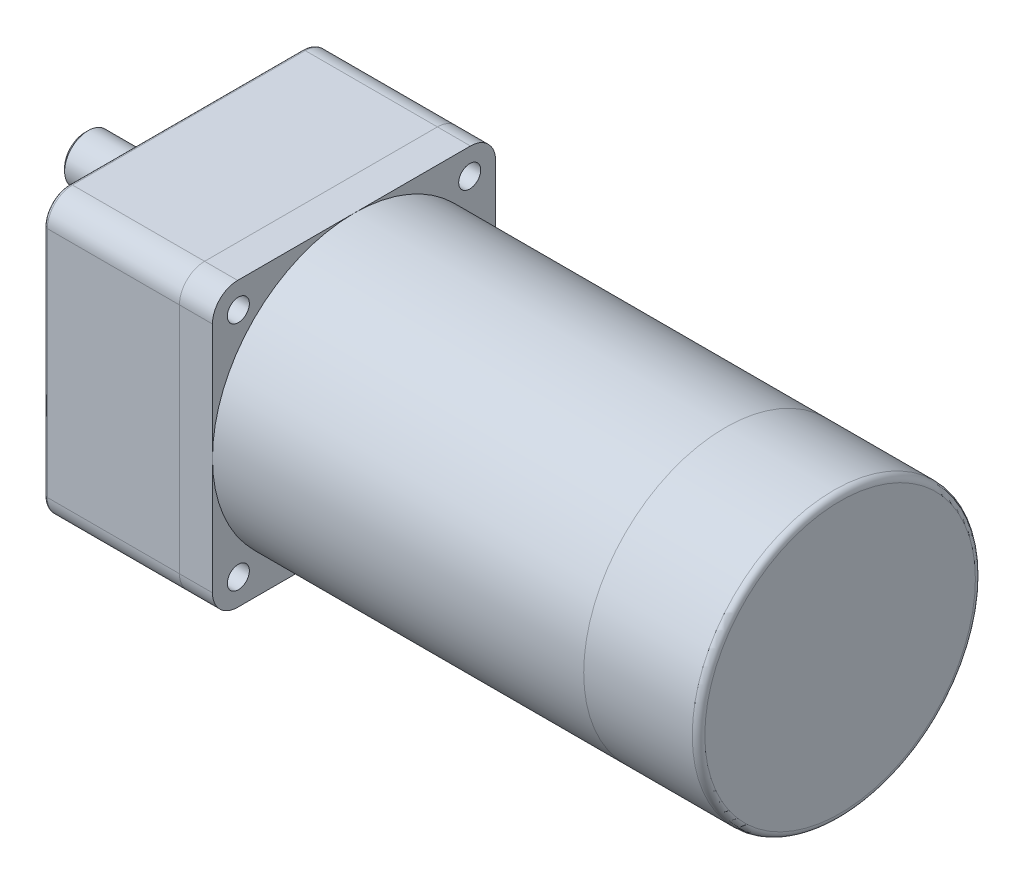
SolidWorks part; units mm, degrees
ref_plane "前视基准面" through (0, 0, 0) normal (0, 0, 1) x (1, 0, 0)
ref_plane "上视基准面" through (0, 0, 0) normal (0, 1, 0) x (1, 0, 0)
ref_plane "右视基准面" through (0, 0, 0) normal (1, 0, 0) x (0, 0, -1)
sketch "草图1" plane through (0, 0, 0) normal (1, 0, 0) x (0, 0, -1)
  line L1 (-37, -45) -> (37, -45)
  line L2 (-45, -37) -> (-45, 37)
  line L3 (-37, 45) -> (37, 45)
  line L4 (45, -37) -> (45, 37)
  line L5 (-45, -45) -> (45, 45) construction
  line L6 (-45, 45) -> (45, -45) construction
  arc A0 (-37, -45) -> (-45, -37) centre (-37, -37) cw
  arc A1 (37, -45) -> (45, -37) centre (37, -37) ccw
  arc A2 (37, 45) -> (45, 37) centre (37, 37) cw
  arc A3 (-45, 37) -> (-37, 45) centre (-37, 37) cw
  point P0 (0, 0)
  dimension "D1" = 8
extrude "凸台-拉伸1" add sketch "草图1" along normal blind 43
sketch "草图2" plane through (43, 0, 0) normal (1, 0, 0) x (0, 0, -1)
  line L0 (37, 45) -> (-37, 45) construction
  line L1 (-37, -45) -> (37, -45)
  line L2 (-45, -37) -> (-45, 37)
  line L3 (-37, 45) -> (37, 45)
  line L4 (45, -37) -> (45, 37)
  line L5 (-45, -45) -> (45, 45) construction
  line L6 (-45, 45) -> (45, -45) construction
  arc A0 (37, 45) -> (45, 37) centre (37, 37) cw
  arc A1 (37, -45) -> (45, -37) centre (37, -37) ccw
  arc A2 (-37, -45) -> (-45, -37) centre (-37, -37) cw
  arc A3 (-45, 37) -> (-37, 45) centre (-37, 37) cw
  point P0 (0, 0)
  dimension "D1" = 8
extrude "凸台-拉伸2" add sketch "草图2" along normal blind 10.5 separate body
fillet "圆角1" radius 1 8 edges at (0, -45, 0) (0, -42.6569, -42.6569) (0, 0, -45) (0, 42.6569, -42.6569) (0, 45, 0) (0, 42.6569, 42.6569) (0, 0, 45) (0, -42.6569, 42.6569)
sketch "草图6" plane through (0, 0, 0) normal (-1, 0, 0) x (0, 0, 1)
  circle A0 centre (0, 18) radius 16
extrude "凸台-拉伸5" add sketch "草图6" along normal blind 3 separate body
fillet "圆角3" radius 0.5 1 edges at (-3, 18, 16)
sketch "草图7" plane through (-3, 0, 0) normal (-1, 0, 0) x (0, 0, 1)
  circle A0 centre (0, 18) radius 7.5
extrude "凸台-拉伸6" add sketch "草图7" along normal blind 29 separate body
ref_plane "基准面1" through (0, 0, -7.5) normal (0, 0, 1) x (1, 0, 0)
sketch "草图8" plane through (0, 0, -7.5) normal (0, 0, 1) x (1, 0, 0)
  line L1 (-32, 25.5) -> (-32, 10.5) construction
  line L2 (-9.5, 20.5) -> (-32, 20.5)
  line L3 (-32, 20.5) -> (-32, 15.5)
  line L4 (-32, 15.5) -> (-9.5, 15.5)
  arc A0 (-9.5, 15.5) -> (-9.5, 20.5) centre (-9.5, 18) ccw
extrude "切除-拉伸2" cut sketch "草图8" along normal blind 3
chamfer "倒角2" distance 1 angle 45 1 edges at (-32, 18, 7.5)
sketch "草图9" plane through (0, 0, 0) normal (-1, 0, 0) x (0, 0, 1)
  circle A0 centre (0, 0) radius 41.4
extrude "切除-拉伸3" cut sketch "草图9" against normal blind 0.5
fillet "圆角4" radius 0.5 1 edges at (0, 0, 41.4)
sketch "草图10" plane through (0, 0, 0) normal (-1, 0, 0) x (0, 0, 1)
  point P19 (-36.7696, 36.7696)
  point P20 (36.7696, 36.7696)
  point P21 (36.7696, -36.7696)
  point P22 (-36.7696, -36.7696)
hole_wizard "M6 螺纹孔1" positions "3D草图1" profile "草图11" tap size "M6" standard "GB"
sketch3d "3D草图1"
  point P0 (0, 36.7696, -36.7696)
  point P3 (0, 36.7696, 36.7696)
  point P6 (0, -36.7696, 36.7696)
  point P9 (0, -36.7696, -36.7696)
sketch "草图11" plane through (0, 36.7696, -36.7696) normal (0, 1, 0) x (0, 0, 1)
  line L0 (0, 0) -> (0, 18.5022)
  line L1 (0, 18.5022) -> (2.5, 17)
  line L2 (2.5, 17) -> (2.5, 0)
  line L5 (2.5, 0) -> (0, 0)
  line L10 (0, 18.5022) -> (-2.5, 17) construction
  line L11 (0, -6.35) -> (0, 107.95) construction
  dimension "螺纹孔钻头直径" = 5
  dimension "螺纹孔钻头深度" = 17
  dimension "导头角度" = 118
sketch "草图13" plane through (53.5, 0, 0) normal (1, 0, 0) x (0, 0, -1)
  circle A0 centre (-36.7696, 36.7696) radius 3.5
  circle A1 centre (36.7696, 36.7696) radius 3.5
  circle A2 centre (36.7696, -36.7696) radius 3.5
  circle A3 centre (-36.7696, -36.7696) radius 3.5
extrude "切除-拉伸4" cut sketch "草图13" against normal blind 44
fillet "圆角5" radius 1 4 edges at (0, -36.7696, -34.2696) (0, -36.7696, 39.2696) (0, 36.7696, 39.2696) (0, 36.7696, -34.2696)
sketch "草图14" plane through (53.5, 0, 0) normal (1, 0, 0) x (0, 0, -1)
  circle A0 centre (0, 0) radius 45
extrude "凸台-拉伸7" add sketch "草图14" along normal blind 118 separate body
sketch "草图15" plane through (171.5, 0, 0) normal (1, 0, 0) x (0, 0, -1)
  circle A0 centre (0, 0) radius 45
extrude "凸台-拉伸8" add sketch "草图15" along normal blind 36.5 separate body
fillet "圆角6" radius 2 1 edges at (208, 0, -45)
